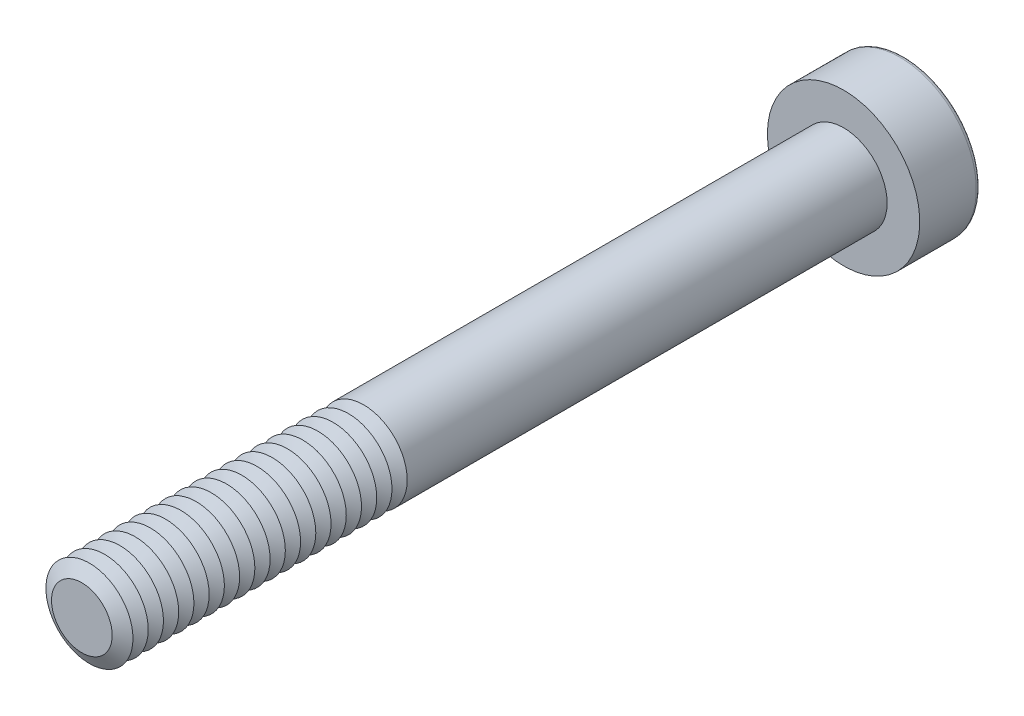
SolidWorks part; units mm, degrees
ref_plane "Front Plane" through (0, 0, 0) normal (0, 0, 1) x (1, 0, 0)
ref_plane "Top Plane" through (0, 0, 0) normal (0, 1, 0) x (1, 0, 0)
ref_plane "Right Plane" through (0, 0, 0) normal (1, 0, 0) x (0, 0, -1)
sketch "Sketch1" plane through (0, 0, 0) normal (0, 0, 1) x (1, 0, 0)
  circle A0 centre (0, 0) radius 2
  dimension "D1" = 4
extrude "Boss-Extrude1" add sketch "Sketch1" along normal blind 35
sketch "Sketch2" plane through (0, 0, 0) normal (0, 0, -1) x (-1, 0, 0)
  circle A0 centre (0, 0) radius 3.5
  dimension "D1" = 7
extrude "Boss-Extrude2" add sketch "Sketch2" along normal blind 2.8
sketch "Sketch3" plane through (0, 0, -2.8) normal (0, 0, -1) x (-1, 0, 0)
  line L1 (-0.7217, 1.25) -> (-1.4434, 0)
  line L2 (-1.4434, 0) -> (-0.7217, -1.25)
  line L3 (-0.7217, -1.25) -> (0.7217, -1.25)
  line L4 (0.7217, -1.25) -> (1.4434, 0)
  line L5 (1.4434, 0) -> (0.7217, 1.25)
  line L6 (0.7217, 1.25) -> (-0.7217, 1.25)
  circle A0 centre (0, 0) radius 1.25 construction
  dimension "D1" = 2.5
extrude "Cut-Extrude1" cut sketch "Sketch3" against normal blind 1.875
fillet "Fillet1" radius 0.2 1 edges at (-3.5, 0, -2.8)
sketch "Sketch4" plane through (0, 0, -0.925) normal (0, 0, -1) x (-1, 0, 0)
  line L0 (0.7217, -1.25) -> (1.4434, 0) construction
  circle A0 centre (0, 0) radius 1.25
extrude "Cut-Extrude2" cut sketch "Sketch4" against normal through all draft 60
sketch "Sketch5" plane through (0, 0, -2.8) normal (0, 0, -1) x (-1, 0, 0)
  circle A0 centre (0, 0) radius 1.4434
extrude "Cut-Extrude3" cut sketch "Sketch5" against normal through all draft 75
sketch "Sketch7" plane through (0, 0, 0) normal (1, 0, 0) x (0, 0, -1)
  line L25 (-35, 1.3938) -> (-34.65, 2)
  line L26 (-35, 2) -> (-35, -2) construction
  line L27 (-34.65, 2) -> (-35.35, 2)
  line L28 (-35.35, 2) -> (-35, 1.3938)
  line L29 (0, 2) -> (-35, 2) construction
  dimension "D1" = 0.7
revolve "Cut-Revolve1" cut sketch "Sketch7" angle 360 about axis through (0, 0, 35) along (0, 0, -1)
pattern_linear "LPattern1" count 19 spacing 0.7 along (0, 0, -1) of "Cut-Revolve1"
